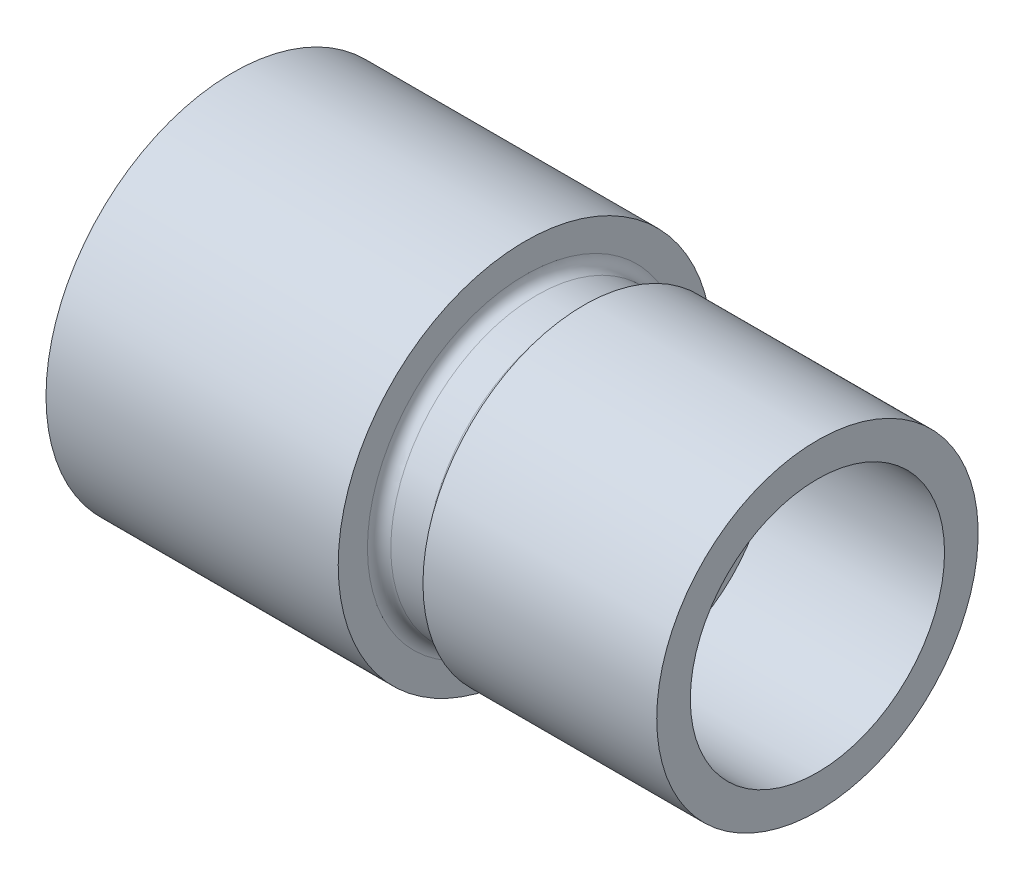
SolidWorks part; units mm, degrees
ref_plane "Plan de face" through (0, 0, 0) normal (0, 0, 1) x (1, 0, 0)
ref_plane "Plan de dessus" through (0, 0, 0) normal (0, 1, 0) x (1, 0, 0)
ref_plane "Plan de droite" through (0, 0, 0) normal (1, 0, 0) x (0, 0, -1)
sketch "Esquisse1" plane through (0, 0, 0) normal (0, 0, 1) x (1, 0, 0)
  line L0 (0, 0) -> (10.092, 0) construction
  line L1 (0, 6.4) -> (0, 4.325)
  line L2 (0, 6.4) -> (10, 6.4)
  line L3 (20, 5.5) -> (20, 4.35)
  line L4 (20, 4.35) -> (14, 4.35)
  line L5 (14, 4.35) -> (14, 2.65)
  line L6 (14, 2.65) -> (12, 2.65)
  line L7 (12, 2.65) -> (12, 4.325)
  line L8 (12, 4.325) -> (0, 4.325)
  line L9 (12, 5.5) -> (20, 5.5)
  line L10 (10, 6.4) -> (10, 5.4)
  line L11 (10.4, 5) -> (11.6, 5)
  line L12 (12, 5.5) -> (12, 5.4)
  arc A0 (10, 5.4) -> (10.4, 5) centre (10.4, 5.4) ccw
  arc A1 (12, 5.4) -> (11.6, 5) centre (11.6, 5.4) cw
  dimension "D9" = 2
  dimension "D11" = 0.4
  dimension "D1" = 8.65
  dimension "D2" = 12.8
  dimension "D3" = 6
  dimension "D4" = 8.7
  dimension "D5" = 5.3
  dimension "D6" = 10
  dimension "D7" = 12
  dimension "D8" = 20
  dimension "D10" = 10
  dimension "D12" = 11
revolve "Révolution1" add sketch "Esquisse1" angle 360 about L0
